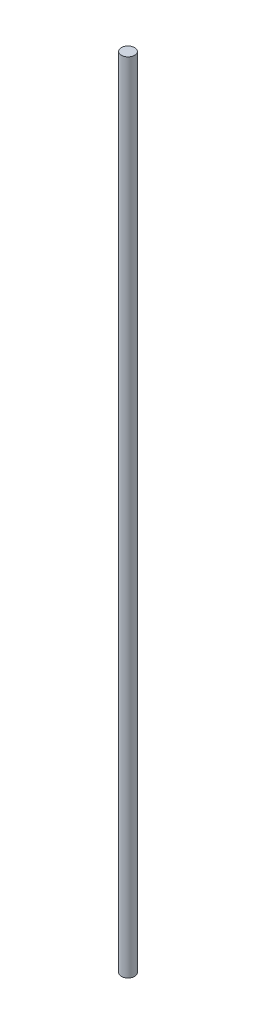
SolidWorks part; units mm, degrees
ref_plane "Front Plane" through (0, 0, 0) normal (0, 0, 1) x (1, 0, 0)
ref_plane "Top Plane" through (0, 0, 0) normal (0, 1, 0) x (1, 0, 0)
ref_plane "Right Plane" through (0, 0, 0) normal (1, 0, 0) x (0, 0, -1)
sketch "Sketch1" plane through (0, 0, 0) normal (0, 1, 0) x (1, 0, 0)
  circle A0 centre (0, 0) radius 12.7
extrude "Extrude1" add sketch "Sketch1" along normal blind 1524
ref_plane "Plane1" through (0, 0, 0) normal (1, 0, 0) x (0, 0, -1)
ref_plane "Plane2" through (0, 0, 0) normal (0, 0, 1) x (1, 0, 0)
